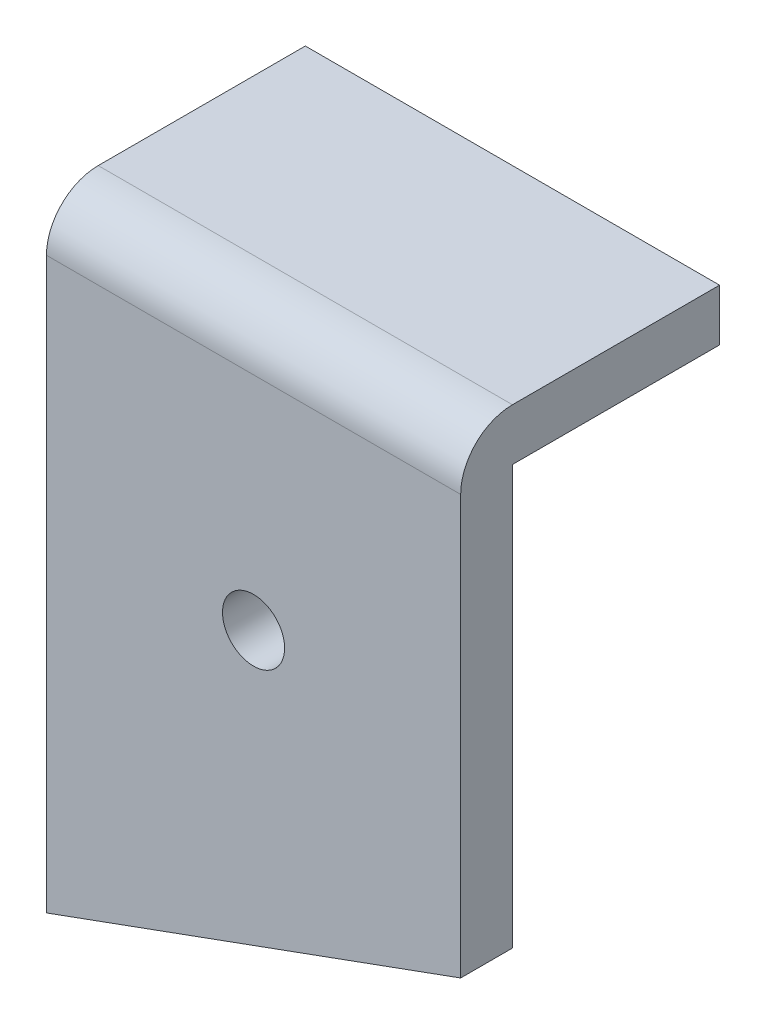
SolidWorks part; units mm, degrees
ref_plane "Plan de face" through (0, 0, 0) normal (0, 0, 1) x (1, 0, 0)
ref_plane "Plan de dessus" through (0, 0, 0) normal (0, 1, 0) x (1, 0, 0)
ref_plane "Plan de droite" through (0, 0, 0) normal (1, 0, 0) x (0, 0, -1)
sketch "Esquisse1" plane through (0, 0, 0) normal (0, 0, 1) x (1, 0, 0)
  line L0 (0, 0) -> (80, 0)
  line L1 (0, 0) -> (0, -120)
  line L2 (0, -120) -> (80, -90.8824)
  line L3 (80, 0) -> (80, -90.8824)
  line L6 (40, 0) -> (40, -111.8747) construction
  line L7 (0, -60) -> (80, -45.4412) construction
  circle A0 centre (40, -52.7206) radius 6
  dimension "D4" = 12
  dimension "D1" = 80
  dimension "D2" = 120
  dimension "D3" = 110
extrude "Extrusion1" add sketch "Esquisse1" along normal blind 10
sketch "Esquisse2" plane through (0, 0, 0) normal (0, 0, -1) x (-1, 0, 0)
  line L0 (0, 0) -> (0, -120) construction
  line L1 (-80, 0) -> (0, 0)
  line L2 (-80, 0) -> (-80, -10)
  line L3 (-80, -10) -> (0, -10)
  line L4 (0, 0) -> (0, -10)
  dimension "D1" = 10
extrude "Extrusion2" add sketch "Esquisse2" along normal blind 40
fillet "Congé1" radius 10 1 edges at (40, 0, 10)
